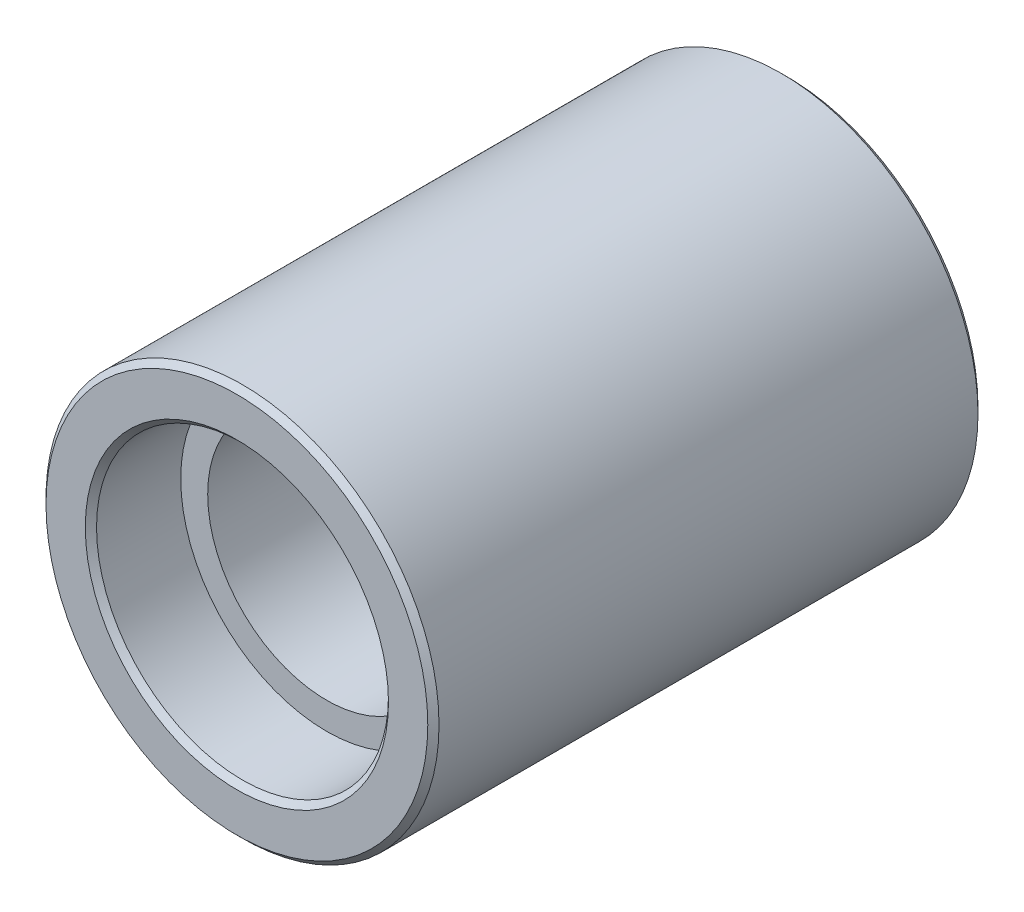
SolidWorks part; units mm, degrees
ref_plane "Plan1" through (0, 0, 0) normal (0, 0, 1) x (1, 0, 0)
ref_plane "Plan2" through (0, 0, 0) normal (0, 1, 0) x (1, 0, 0)
ref_plane "Plan3" through (0, 0, 0) normal (1, 0, 0) x (0, 0, -1)
sketch "Esquisse1" plane through (0, 0, 0) normal (0, 0, 1) x (1, 0, 0)
  circle A0 centre (0, 0) radius 17.5
  dimension "D1" = 35
extrude "Base-Extrusion" add sketch "Esquisse1" along normal mid plane 49
sketch "Esquisse3" plane through (0, 0, -24.5) normal (0, 0, -1) x (-1, 0, 0)
  circle A0 centre (0, 0) radius 13
  dimension "D1" = 26
extrude "Enlèv. mat.-Extru.2" cut sketch "Esquisse3" against normal blind 8
sketch "Esquisse4" plane through (0, 0, -24.5) normal (0, 0, -1) x (-1, 0, 0)
  circle A0 centre (0, 0) radius 10.6
  dimension "D1" = 21.2
extrude "Enlèv. mat.-Extru.3" cut sketch "Esquisse4" against normal through all
sketch "Esquisse5" plane through (0, 0, 24.5) normal (0, 0, 1) x (1, 0, 0)
  circle A0 centre (0, 0) radius 13
  dimension "D1" = 26
extrude "Enlèv. mat.-Extru.4" cut sketch "Esquisse5" against normal blind 8
chamfer "Chanfrein2" distance 0.5 angle 45
